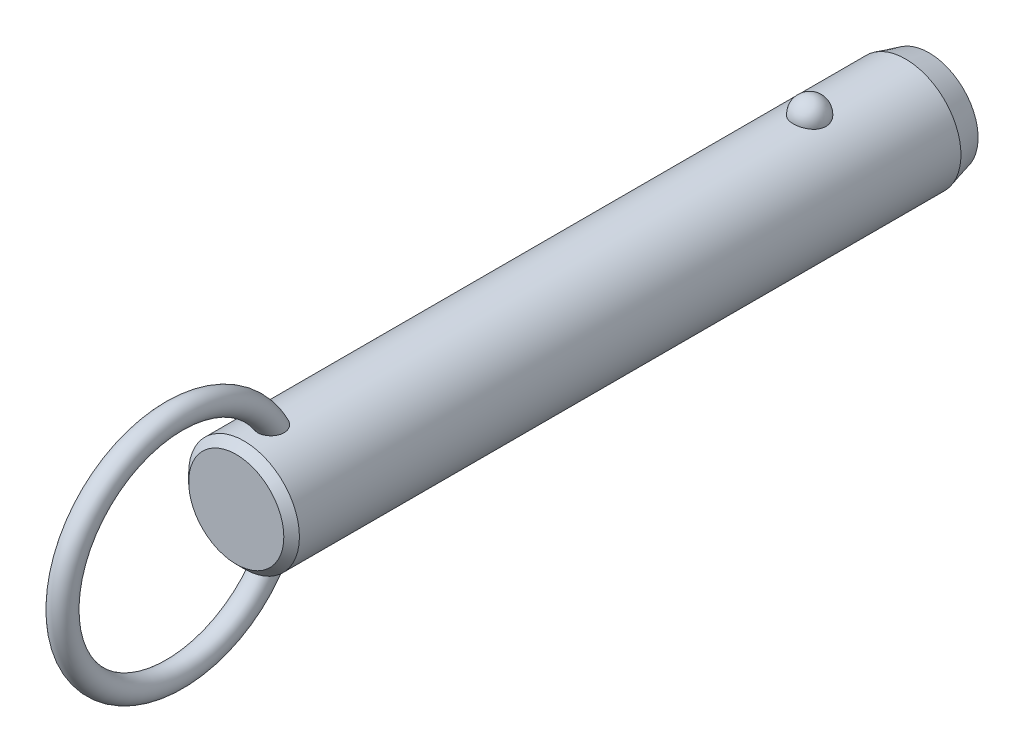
SolidWorks part; units mm, degrees
ref_plane "Front Plane" through (0, 0, 0) normal (0, 0, 1) x (1, 0, 0)
ref_plane "Top Plane" through (0, 0, 0) normal (0, 1, 0) x (1, 0, 0)
ref_plane "Right Plane" through (0, 0, 0) normal (1, 0, 0) x (0, 0, -1)
sketch "Sketch2" plane through (0, 0, 0) normal (0, 0, 1) x (1, 0, 0)
  circle A0 centre (0, 0) radius 7.1
  point P3 (0, 7.1)
  dimension "D1" = 14.2
extrude "Boss-Extrude1" add sketch "Sketch2" along normal blind 63.5
sketch "Sketch3" plane through (0, 0, 0) normal (0, 0, -1) x (-1, 0, 0)
  circle A0 centre (0, 0) radius 7.1
  dimension "D1" = 14.2
extrude "Boss-Extrude2" add sketch "Sketch3" along normal blind 17.4
chamfer "Chamfer1" distance 3 angle 15 1 edges at (-7.1, 0, -17.4)
sketch "Sketch12" plane through (0, 0, 0) normal (1, 0, 0) x (0, 0, -1)
  line L0 (-63.5, 7.1) -> (-63.5, -7.1) construction
  point P0 (-63.5, 0)
sketch "Sketch13" plane through (0, 0, 0) normal (1, 0, 0) x (0, 0, -1)
  circle A0 centre (-79.35, 0) radius 15.85
  point P2 (-63.5, 0)
  dimension "D1" = 31.7
sketch "Sketch14" plane through (0, 0, 0) normal (0, 1, 0) x (1, 0, 0)
  circle A0 centre (0, -65) radius 1.5
  point P2 (0, -63.5)
  dimension "D1" = 3
sweep "Sweep1" add profiles "Sketch14" path "Sketch13"
sketch "Sketch15" plane through (0, 0, 63.5) normal (0, 0, 1) x (1, 0, 0)
  circle A0 centre (0, 0) radius 7.1
  dimension "D1" = 14.2
extrude "Boss-Extrude3" add sketch "Sketch15" along normal blind 7.92
chamfer "Chamfer2" distance 1 angle 45 1 edges at (7.1, 0, 71.42)
sketch "Sketch18" plane through (0, 0, 0) normal (1, 0, 0) x (0, 0, -1)
  line L0 (14.4, 7.1) -> (-65.1792, 7.1) construction
  line L1 (2.1, 9.2) -> (2.1, 5)
  line L2 (-65.1792, -7.1) -> (14.4, -7.1) construction
  arc A0 (2.1, 9.2) -> (2.1, 5) centre (2.1, 7.1) ccw
  point P4 (0, 7.1)
  dimension "D1" = 16.3
revolve "Revolve1" add sketch "Sketch18" angle 360 about L1
